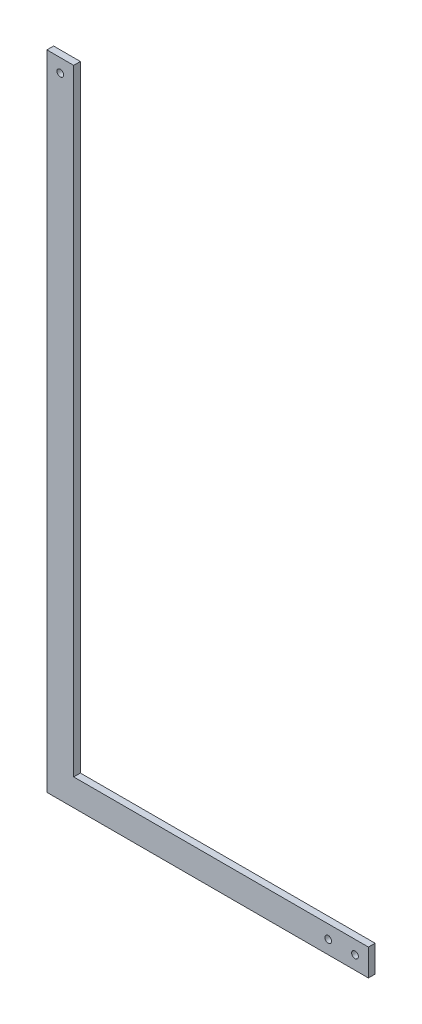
SolidWorks part; units mm, degrees
ref_plane "정면" through (0, 0, 0) normal (0, 0, 1) x (1, 0, 0)
ref_plane "윗면" through (0, 0, 0) normal (0, 1, 0) x (1, 0, 0)
ref_plane "우측면" through (0, 0, 0) normal (1, 0, 0) x (0, 0, -1)
sketch "스케치1" plane through (0, 0, 0) normal (0, 0, 1) x (1, 0, 0)
  line L0 (-24.1508, 246.5049) -> (-24.1508, -58.2951)
  line L1 (-24.1508, -58.2951) -> (128.2492, -58.2951)
  line L2 (128.2492, -58.2951) -> (128.2492, -45.5951)
  line L3 (128.2492, -45.5951) -> (-11.4508, -45.5951)
  line L4 (-11.4508, -45.5951) -> (-11.4508, 246.5049)
  line L5 (-11.4508, 246.5049) -> (-24.1508, 246.5049)
  circle A0 centre (-17.8008, 240.1549) radius 1.5875
  circle A1 centre (109.1992, -51.9451) radius 1.5875
  circle A2 centre (121.8992, -51.9451) radius 1.5875
  dimension "D5" = 6.35
  dimension "D7" = 3.175
  dimension "D8" = 6.35
  dimension "D10" = 3.175
  dimension "D11" = 3.175
  dimension "D1" = 12.7
  dimension "D2" = 12.7
  dimension "D3" = 304.8
  dimension "D4" = 152.4
  dimension "D6" = 6.35
  dimension "D9" = 12.7
  dimension "D12" = 6.35
  dimension "D13" = 6.35
extrude "보스-돌출1" add sketch "스케치1" along normal blind 3.175
